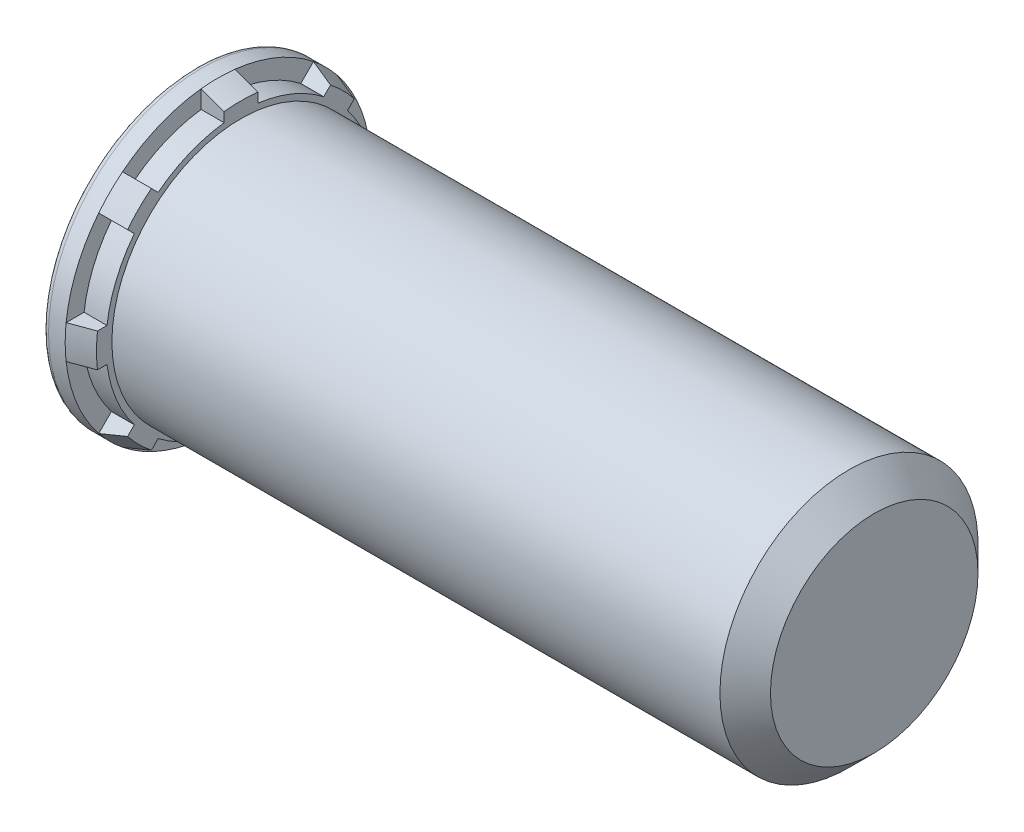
SolidWorks part; units mm, degrees
revolve "BaseBody" add sketch "BodySke" angle 360 about L6
sketch "BodySke" plane through (0, 0, 0) normal (0, 0, 1) x (1, 0, 0)
  line L0 (-0.4286, 2.7407) -> (-0.4286, 0)
  line L1 (0.4286, 2.7015) -> (0.4286, 2.413)
  line L2 (0, 2.8575) -> (0.4286, 2.7015)
  line L3 (0.4286, 2.413) -> (11.7989, 2.413)
  line L4 (12.2714, 1.9406) -> (12.2714, 0)
  line L5 (12.2714, 0) -> (-0.4286, 0)
  line L6 (0, 0) -> (50.554, 0) construction
  line L7 (-0.4286, 2.7407) -> (-0.4261, 2.7407)
  line L8 (12.2714, 1.9406) -> (11.7989, 2.413)
  line L9 (-0.3118, 2.8575) -> (0, 2.8575)
  line L11 (0.7925, 19.05) -> (0.7925, -3.175) construction
  line L13 (-0.4261, 2.7407) -> (-0.4261, 2.7432)
  arc A0 (-0.4261, 2.7432) -> (-0.3118, 2.8575) centre (-0.3118, 2.7432) cw
ref_plane "Plane1" through (0, 0, 0) normal (0, 0, 1) x (1, 0, 0)
ref_plane "Plane2" through (0, 0, 0) normal (0, 1, 0) x (1, 0, 0)
ref_plane "Plane3" through (0, 0, 0) normal (1, 0, 0) x (0, 0, -1)
other "Configuration Table"
sketch "ThdSchSke" plane through (0, 0, 0) normal (0, 0, 1) x (1, 0, 0)
  line L0 (2.1114, -1.9406) -> (1.7806, -2.413)
  line L1 (2.1114, -1.9406) -> (2.4422, -2.413)
  line L2 (2.4422, -2.413) -> (2.4422, -3.0162)
  line L3 (-3.175, 0) -> (5.1513, 0) construction
  line L5 (2.4422, -3.0162) -> (1.7806, -3.0162)
  line L6 (1.7806, -3.0162) -> (1.7806, -2.413)
  line L7 (-0.4286, 2.7407) -> (-0.4286, -2.7407) construction
revolve "ThreadSchematic" [suppressed] cut sketch "ThdSchSke" angle 360 about L3
pattern_linear "ThdSchPat" [suppressed]
sketch "RibCutSke" plane through (0.4286, 1.7944, -0.091) normal (1, 0, 0) x (0, 0, -1)
  line L0 (0.224, 0.71) -> (0.224, 1.0457)
  line L1 (1.4572, 0.1992) -> (1.6946, 0.4366)
  line L2 (0.224, 0.598) -> (0.224, 0.0891) construction
  line L3 (-0.091, -1.7944) -> (-0.091, 5.0239) construction
  line L4 (-0.091, -1.7944) -> (0.224, 0.598) construction
  line L5 (-0.091, -1.7944) -> (1.378, 0.12) construction
  line L6 (1.378, 0.12) -> (1.0232, -0.2348) construction
  arc A1 (1.4572, 0.1992) -> (0.224, 0.71) centre (-0.091, -1.7944) ccw
  arc A2 (1.6946, 0.4366) -> (0.224, 1.0457) centre (-0.091, -1.7944) ccw
  circle A3 centre (-0.091, -1.7944) radius 2.7015 construction
  circle A4 centre (-0.091, -1.7944) radius 2.413 construction
extrude "RibCut" cut sketch "RibCutSke" against normal blind 0.4286
pattern_circular "RibCutsPat" count 8 every 45 about axis through (0, 0, 0) along (1, 0, 0) of "RibCut"
equation "' \"Length@BodySke\" = 0.5"
equation "' \"H_dia@BodySke\" = 0.225"
equation "' \"Start@ThdSchSke\" = 0.1"
equation "' \"Diameter@BodySke\" = 0.19"
equation "' \"Minor_dia@BodySke\" = 0.1528"
equation "' \"Advance@BodySke\" = 0.0312"
equation "\"Fillet_rad@BodySke\" =   \"H_dia@BodySke\" *0.02"
equation "\"Clinch_ht@BodySke\" = \"H_dia@BodySke\" * 0.075"
equation "\"Head_ht@BodySke\" =  \"H_dia@BodySke\" * 0.15"
equation "\"Num_ribs@RibCutsPat\" = 8"
equation "\"Angle@RibCutSke\" =\"Angle@RibCutsPat\""
equation "\"Rib_root_half_angle@RibCutSke\" = \"Angle@RibCutSke\" / 6"
equation "\"Rib_root_gap_angle@RibCutSke\" = \"Angle@RibCutSke\" - (2 * \"Rib_root_half_angle@RibCutSke\" )"
equation "\"Rib_root_dia@RibCutSke\" = \"Diameter@BodySke\""
equation "\"Inner_dia@RibCutSke\" = \"Diameter@BodySke\" + ( \"H_dia@BodySke\" - \"Diameter@BodySke\" ) / 4"
equation "\"Outer_dia@RibCutSke\" = \"H_dia@BodySke\""
equation "\"Depth@RibCut\" = \"Clinch_ht@BodySke\""
equation "\"Thread_length@ThreadCosmetic\" = \"Length@BodySke\" - \"Start@ThdSchSke\""
equation "\"Thread_minor@ThreadCosmetic\" = \"Minor_dia@BodySke\""
equation "\"Thread_minor@ThdSchSke\" = \"Minor_dia@BodySke\""
equation "\"Diameter@ThdSchSke\" = \"Diameter@BodySke\""
equation "\"Overcut@ThdSchSke\" = \"Diameter@BodySke\" * 1.25"
equation "\"Num_threads@ThdSchPat\" = int( \"Thread_length@ThreadCosmetic\" / \"Advance@BodySke\" + 0.999 )  + 1"
equation "\"Advance@ThdSchPat\" = \"Thread_length@ThreadCosmetic\" /  (\"Num_threads@ThdSchPat\" - 1) 'relax it"
equation "\"Num_threads@ThdSchPat\" = \"Num_threads@ThdSchPat\" - sgn( \"Num_threads@ThdSchPat\" - 1) '---chamfered tips only---"
